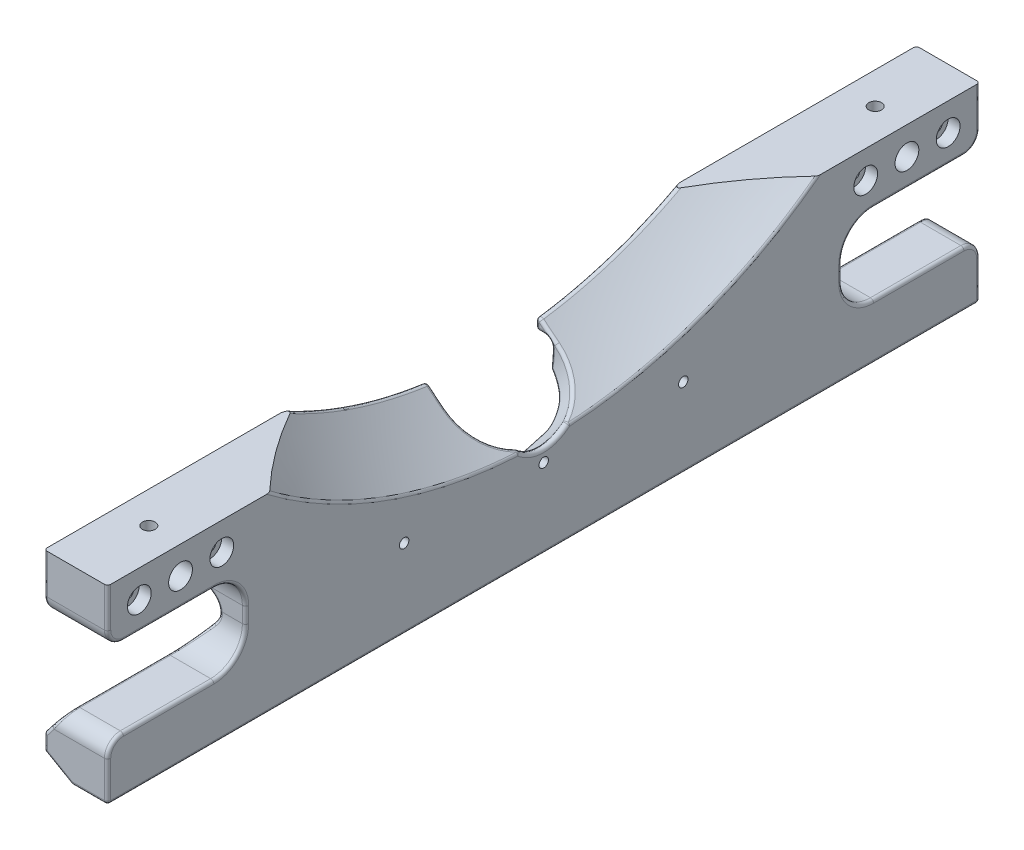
SolidWorks part; units mm, degrees
ref_plane "Front Plane" through (0, 0, 0) normal (0, 0, 1) x (1, 0, 0)
ref_plane "Top Plane" through (0, 0, 0) normal (0, 1, 0) x (1, 0, 0)
ref_plane "Right Plane" through (0, 0, 0) normal (1, 0, 0) x (0, 0, -1)
sketch "Sketch1" plane through (0, 0, 0) normal (0, 0, 1) x (1, 0, 0)
  line L0 (-140.462, -215.9) -> (-124.6241, -225.044)
  line L1 (-140.462, -146.05) -> (-115.062, -146.05)
  line L2 (-140.462, -146.05) -> (-140.462, -215.9)
  line L4 (-115.062, -146.05) -> (-115.062, -225.044)
  line L5 (-124.6241, -225.044) -> (-115.062, -225.044)
  dimension "D1" = 115.062
  dimension "D2" = 25.4
  dimension "D3" = 146.05
  dimension "D4" = 69.85
  dimension "D5" = 60
  dimension "D6" = 78.994
extrude "Boss-Extrude1" add sketch "Sketch1" along normal mid plane 349.25
sketch "Sketch11" plane through (-140.462, 0, 0) normal (-1, 0, 0) x (0, 0, 1)
  line L0 (0, 0) -> (0, -265.0834) construction
  line L1 (-174.625, -146.05) -> (-22.225, -146.05)
  line L2 (-174.625, -146.05) -> (-174.625, -168.275)
  line L3 (-174.625, -168.275) -> (-22.225, -168.275)
  line L4 (-22.225, -146.05) -> (-22.225, -168.275)
  line L5 (22.225, -146.05) -> (22.225, -168.275)
  line L6 (174.625, -168.275) -> (22.225, -168.275)
  line L7 (174.625, -146.05) -> (174.625, -168.275)
  line L8 (174.625, -146.05) -> (22.225, -146.05)
  dimension "D1" = 152.4
extrude "Boss-Extrude2" [suppressed] add sketch "Sketch11" along normal blind 38.1
sketch "Sketch2" plane through (0, 0, 0) normal (0, 0, 1) x (1, 0, 0)
  line L0 (0, 0) -> (0, -257.1396) construction
  line L1 (-199.2378, -83.1693) -> (-29.8683, -83.1693)
  line L2 (-29.8683, -83.1693) -> (-29.8683, -213.824)
  arc A0 (-199.2378, -83.1693) -> (-29.8683, -213.824) centre (0, 0) ccw
  dimension "D1" = 215.9
revolve "Cut-Revolve1" cut sketch "Sketch2" angle 360 about L0
sketch "Sketch4" plane through (-140.462, 0, 0) normal (-1, 0, 0) x (0, 0, 1)
  line L0 (174.625, -146.05) -> (174.625, -215.9) construction
  line L1 (174.625, -168.275) -> (132.08, -168.275)
  line L2 (174.625, -168.275) -> (174.625, -200.025)
  line L3 (174.625, -200.025) -> (132.08, -200.025)
  line L4 (119.38, -180.975) -> (119.38, -187.325)
  line L6 (0, 0) -> (0, -251.7179) construction
  line L7 (-119.38, -180.975) -> (-119.38, -187.325)
  line L8 (-174.625, -200.025) -> (-132.08, -200.025)
  line L9 (-174.625, -168.275) -> (-174.625, -200.025)
  line L10 (-174.625, -168.275) -> (-132.08, -168.275)
  line L11 (174.625, -146.05) -> (74.516, -146.05) construction
  arc A0 (132.08, -168.275) -> (119.38, -180.975) centre (132.08, -180.975) ccw
  arc A1 (132.08, -200.025) -> (119.38, -187.325) centre (132.08, -187.325) cw
  arc A2 (-119.38, -187.325) -> (-132.08, -200.025) centre (-132.08, -187.325) cw
  arc A3 (-119.38, -180.975) -> (-132.08, -168.275) centre (-132.08, -180.975) ccw
  point P17 (119.38, -168.275)
  point P20 (119.38, -200.025)
  point P23 (-119.38, -200.025)
  point P26 (-119.38, -168.275)
  dimension "D3" = 12.7
  dimension "D1" = 53.975
  dimension "D2" = 31.75
  dimension "D4" = 119.38
  dimension "D5" = 22.225
extrude "Cut-Extrude1" cut sketch "Sketch4" against normal through all
hole_wizard "#10-24 Tapped Hole1" positions "Sketch7" profile "Sketch6" tap size "#10-24" standard "ANSI Inch"
sketch "Sketch7" plane through (0, -146.05, 0) normal (0, 1, 0) x (1, 0, 0)
  point P10 (-165.862, 88.265)
  point P16 (-165.862, -88.265)
sketch "Sketch6" plane through (-165.862, -146.05, -88.265) normal (1, 0, 0) x (0, 0, 1)
  line L0 (0, 0) -> (0, 78.994)
  line L1 (0, 78.994) -> (1.8986, 78.994)
  line L2 (1.8986, 78.994) -> (1.8986, 0)
  line L5 (1.8986, 0) -> (0, 0)
  line L11 (0, -6.35) -> (0, 107.95) construction
  dimension "Thru Tap Drill Dia." = 3.7973
  dimension "Thru Tap Drill Depth" = 78.994
hole_wizard "#10 Clearance Hole1" positions "Sketch19" profile "Sketch18" hole size "#10" standard "ANSI Inch"
sketch "Sketch19" plane through (0, -168.275, 0) normal (0, -1, 0) x (-1, 0, 0)
  point P0 (165.862, -145.415)
  point P3 (127.762, -145.415)
  point P6 (165.862, 145.415)
  point P9 (127.762, 145.415)
sketch "Sketch18" plane through (-165.862, -168.275, 145.415) normal (1, 0, 0) x (0, 0, -1)
  line L0 (0, 0) -> (0, 22.225)
  line L1 (0, 22.225) -> (2.5527, 22.225)
  line L2 (2.5527, 22.225) -> (2.5527, 0)
  line L5 (2.5527, 0) -> (0, 0)
  line L11 (0, -6.35) -> (0, 107.95) construction
  dimension "Thru Hole Dia." = 5.1054
  dimension "Thru Hole Depth" = 22.225
fillet "Fillet3" [suppressed] radius 12.7
sketch "Sketch16" [suppressed] plane through (0, 0, -22.225) normal (0, 0, 1) x (1, 0, 0)
  line L0 (-178.562, -146.05) -> (-157.4429, -146.05) construction
  line L3 (-140.462, -168.275) -> (-140.462, -162.4478) construction
  line L4 (-178.562, -146.05) -> (-157.4429, -146.05)
  line L5 (-178.562, -146.05) -> (-178.562, -168.275)
  line L6 (-178.562, -168.275) -> (-140.462, -168.275)
  line L7 (-140.462, -168.275) -> (-140.462, -162.4478)
  arc A1 (-157.4429, -146.05) -> (-140.462, -162.4478) centre (0, 0) ccw construction
  arc A3 (-157.4429, -146.05) -> (-140.462, -162.4478) centre (0, 0) ccw
extrude "Boss-Extrude4" [suppressed] add sketch "Sketch16" along normal up to surface (44.45 mm away)
fillet "Fillet4" [suppressed] radius 6.35
hole_wizard "#10-24 Tapped Hole3" positions "Sketch13" profile "Sketch12" tap size "#10-24" standard "ANSI Inch"
sketch "Sketch13" plane through (-140.462, 0, 0) normal (-1, 0, 0) x (0, 0, 1)
  line L0 (-55.88, -190.5) -> (116.4714, -190.5) construction
  line L5 (-109.7403, -146.05) -> (-174.625, -146.05) construction
  point P0 (-55.88, -190.5)
  point P2 (0, -190.5)
  point P4 (55.88, -190.5)
  dimension "D1" = 55.88
  dimension "D2" = 55.88
  dimension "D3" = 44.45
sketch "Sketch12" plane through (-140.462, -190.5, -55.88) normal (0, 1, 0) x (0, 0, 1)
  line L0 (0, 0) -> (0, 25.4)
  line L1 (0, 25.4) -> (1.8986, 25.4)
  line L2 (1.8986, 25.4) -> (1.8986, 0)
  line L5 (1.8986, 0) -> (0, 0)
  line L11 (0, -6.35) -> (0, 107.95) construction
  dimension "Thru Tap Drill Dia." = 3.7973
  dimension "Thru Tap Drill Depth" = 25.4
sketch "Sketch17" plane through (0, 0, 0) normal (1, 0, 0) x (0, 0, -1)
  line L0 (-172.6511, -129.6318) -> (172.6511, -129.6318)
  line L1 (-201.1468, 0) -> (223.5225, 0) construction
  arc A0 (172.6511, -129.6318) -> (-172.6511, -129.6318) centre (0, 0) cw
  dimension "D1" = 215.9
revolve "Cut-Revolve4" [suppressed] cut sketch "Sketch17" angle 360 about L1
fillet "Fillet5" [suppressed] radius 12.7
fillet "Fillet6" [suppressed] radius 6.35
fillet "Fillet7" radius 6.35 4 edges at (-127.762, -200.025, -174.625) (-127.762, -168.275, -174.625) (-127.762, -200.025, 174.625) (-127.762, -168.275, 174.625)
sketch "Sketch20" plane through (0, 0, -174.625) normal (0, 0, -1) x (-1, 0, 0)
  line L0 (115.062, -146.05) -> (140.462, -146.05) construction
  line L1 (112.8411, -229.5307) -> (140.256, -229.5307)
  line L2 (112.8411, -229.5307) -> (112.8411, -222.25)
  line L3 (112.8411, -222.25) -> (140.256, -222.25)
  line L4 (140.256, -229.5307) -> (140.256, -222.25)
  dimension "D1" = 76.2
extrude "Cut-Extrude2" cut sketch "Sketch20" against normal through all
hole_wizard "3/8 (0.375) Diameter Hole1" positions "Sketch22" profile "Sketch21" hole size "3/8" standard "ANSI Inch"
sketch "Sketch22" plane through (-140.462, 0, 0) normal (-1, 0, 0) x (0, 0, 1)
  line L0 (-145.415, -175.1062) -> (-145.415, -134.7462) construction
  line L1 (-147.9677, -146.05) -> (-147.9677, -168.275) construction
  line L2 (-142.8623, -168.275) -> (-142.8623, -146.05) construction
  line L5 (-163.2553, -157.1625) -> (-130.2244, -157.1625) construction
  line L6 (-74.516, -146.05) -> (-174.625, -146.05) construction
  line L7 (-132.08, -168.275) -> (-168.275, -168.275) construction
  line L8 (145.415, -139.1729) -> (145.415, -177.9676) construction
  line L10 (142.8623, -146.05) -> (142.8623, -168.275) construction
  line L11 (147.9677, -168.275) -> (147.9677, -146.05) construction
  line L12 (136.7332, -157.1625) -> (151.9983, -157.1625) construction
  line L14 (174.625, -146.05) -> (74.516, -146.05) construction
  line L15 (168.275, -168.275) -> (132.08, -168.275) construction
  point P0 (-145.415, -157.1625)
  point P2 (145.415, -157.1625)
sketch "Sketch21" plane through (-140.462, -157.1625, -145.415) normal (0, 1, 0) x (0, 0, 1)
  line L0 (0, 0) -> (0, 25.4)
  line L1 (0, 25.4) -> (4.7625, 25.4)
  line L2 (4.7625, 25.4) -> (4.7625, 0)
  line L5 (4.7625, 0) -> (0, 0)
  line L11 (0, -6.35) -> (0, 107.95) construction
  dimension "Thru Hole Dia." = 9.525
  dimension "Thru Hole Depth" = 25.4
hole_wizard "CBORE for #10 Socket Head Cap Screw1" positions "Sketch24" profile "Sketch23" counterbore size "#10" standard "ANSI Inch"
sketch "Sketch24" plane through (-115.062, -3.5007, 17.4995) normal (-1, 0, 0) x (0, 0, 1)
  line L0 (-191.3128, -153.6618) -> (-76.1566, -153.6618) construction
  line L1 (-92.0155, -142.5493) -> (-192.1245, -142.5493) construction
  line L2 (-149.5795, -164.7743) -> (-185.7745, -164.7743) construction
  line L3 (-192.1245, -142.5493) -> (-192.1245, -158.4243) construction
  point P8 (-179.4245, -153.6618)
  point P10 (-146.4045, -153.6618)
  dimension "D1" = 12.7
  dimension "D2" = 33.02
sketch "Sketch23" plane through (-115.062, -157.1625, -161.925) normal (0, 1, 0) x (0, 0, -1)
  line L0 (0, 0) -> (0, 25.4)
  line L1 (0, 25.4) -> (2.5527, 25.4)
  line L3 (2.5527, 25.4) -> (2.5527, 4.826)
  line L4 (2.5527, 4.826) -> (4.7625, 4.826)
  line L5 (4.7625, 4.826) -> (4.7625, 0)
  line L7 (4.7625, 0) -> (0, 0)
  line L11 (0, -6.35) -> (0, 107.95) construction
  dimension "Thru Hole Dia." = 5.1054
  dimension "Thru Hole Depth" = 25.4
  dimension "C'Bore Dia." = 9.525
  dimension "C'Bore Depth" = 4.826
mirror "Mirror1" about plane through (0, 0, 0) normal (0, 0, 1) of "CBORE for #10 Socket Head Cap Screw1"
ref_plane "Plane1" through (-114.4688, -146.5134, 0) normal (0.6157, 0.788, 0) x (0, 0, -1)
sketch "Sketch27" plane through (-114.4688, -146.5134, 0) normal (0.6157, 0.788, 0) x (0, 0, -1)
  line L2 (-22.225, 0) -> (-22.225, 38.1)
  line L3 (-22.225, 38.1) -> (22.225, 38.1)
  line L4 (22.225, 0) -> (22.225, 38.1)
  arc A0 (-22.225, 0) -> (22.225, 0) centre (0, 0) ccw
  dimension "D1" = 44.45
  dimension "D2" = 38.1
extrude "Cut-Extrude4" cut sketch "Sketch27" against normal through all
sketch "Sketch28" plane through (-140.462, 0, 0) normal (-1, 0, 0) x (0, 0, 1)
  line L0 (168.275, -168.275) -> (132.08, -168.275) construction
  line L1 (-124.0137, -168.275) -> (122.2507, -168.275)
  line L2 (-124.0137, -168.275) -> (-124.0137, -200.025)
  line L3 (-124.0137, -200.025) -> (122.2507, -200.025)
  line L4 (122.2507, -168.275) -> (122.2507, -200.025)
  line L5 (132.08, -200.025) -> (168.275, -200.025) construction
extrude "Cut-Extrude5" cut sketch "Sketch28" against normal blind 6.35
fillet "Fillet8" radius 3.175 4 edges at (-134.112, -168.275, 72.2378) (-134.112, -200.025, -68.8787) (-134.112, -168.275, -73.1193) (-134.112, -200.025, 67.9972)
fillet "Fillet9" radius 1.27 58 edges at (-135.0419, -169.2049, 22.225) (-134.112, -171.5528, 22.225) (-135.0444, -199.0975, -15.2577) (-135.0419, -169.2049, -22.225) (-134.112, -171.5528, -22.225) (-121.1512, -177.8718, -17.2285) (-136.3807, -165.889, 22.225) (-134.112, -185.2546, 20.5877) (-140.462, -215.8825, 0) (-134.112, -185.2546, -20.5877) (-136.3807, -165.889, -22.225) (-115.062, -214.3125, -174.625) (-115.062, -201.8849, -172.7651) (-115.062, -153.9875, -174.625) (-115.062, -166.4151, -172.7651) (-115.062, -168.275, -150.1775) (-115.062, -171.9947, -123.0997) (-115.062, -184.15, -119.38) (-115.062, -196.3053, -123.0997) (-115.062, -153.9875, 174.625) (-115.062, -166.4151, 172.7651) (-115.062, -168.275, 150.1775) (-115.062, -171.9947, 123.0997) (-115.062, -184.15, 119.38) (-115.062, -196.3053, 123.0997) (-115.062, -214.3125, 174.625) (-115.062, -201.8849, 172.7651) (-140.462, -153.9875, -174.625) (-140.462, -166.4151, -172.7651) (-140.462, -153.9875, 174.625) (-140.462, -166.4151, 172.7651) (-140.462, -211.1375, 174.625) (-140.462, -201.8849, 172.7651) (-140.462, -211.1375, -174.625) (-140.462, -201.8849, -172.7651) (-115.062, -200.025, -150.1775) (-115.062, -200.025, 150.1775) (-140.462, -168.275, -150.1775) (-140.462, -168.275, 150.1775) (-140.462, -200.025, 150.1775) (-140.462, -200.025, -150.1775) (-134.112, -175.7497, -120.5047) (-134.112, -192.5503, -120.5047) (-134.112, -191.5945, 120.1192) (-134.112, -176.7055, 120.1192) (-134.112, -184.15, -119.38) (-134.112, -184.15, 119.38) (-140.462, -169.0195, -127.7957) (-140.462, -169.4984, 126.6414) (-140.462, -198.8016, 126.6414) (-140.462, -199.2805, -127.7957) (-138.8745, -168.275, 22.225) (-138.8297, -200.025, 17.4623) (-134.8919, -198.9342, 15.2369) (-138.8297, -200.025, -17.4623) (-138.8745, -168.275, -22.225)
sketch "Sketch29" plane through (0, 0, -174.625) normal (0, 0, -1) x (-1, 0, 0)
  line L2 (124.582, -189.1656) -> (137.5109, -205.7138)
  line L3 (126.9277, -192.1679) -> (142.7541, -212.4248)
  line L4 (149.8421, -166.2069) -> (142.7541, -212.4248)
  line L5 (149.8421, -166.2069) -> (125.0198, -185.6002)
  line L6 (149.8421, -166.2069) -> (128.0221, -183.2546)
  arc A0 (126.9277, -192.1679) -> (128.0221, -183.2546) centre (131.9315, -188.2584) cw
  dimension "D3" = 6.35
  dimension "D1" = 2.54
  dimension "D2" = 2.54
extrude "Cut-Extrude6" cut sketch "Sketch29" against normal through all and the other way through all
fillet "Fillet10" radius 1.27 59 edges at (-122.8977, -222.25, 174.625) (-115.434, -222.25, 174.253) (-122.8977, -222.25, -174.625) (-115.434, -222.25, -174.253) (-134.3277, -219.4416, 174.625) (-140.09, -216.1148, 174.253) (-140.462, -215.9, 88.4153) (-140.4102, -215.9299, 0.9355) (-134.3277, -219.4416, -174.625) (-140.09, -216.1148, -174.253) (-115.062, -171.8555, 61.9614) (-115.062, -171.8555, -61.9614) (-140.462, -165.48, 22.225) (-140.462, -162.6362, 22.7118) (-140.462, -165.48, -22.225) (-140.462, -162.7971, -22.5774) (-129.4809, -182.1148, 119.38) (-126.4449, -185.0617, 119.38) (-125.6657, -189.2891, 119.5328) (-131.3901, -197.8795, 125.0165) (-133.0663, -200.025, 150.1775) (-134.5194, -201.8849, 172.7651) (-138.6097, -207.1203, 174.625) (-140.09, -209.0149, 174.253) (-140.462, -209.491, 93.3835) (-140.2933, -209.2751, 12.7565) (-140.3729, -209.377, -12.8871) (-133.4716, -200.5438, -12.6264) (-133.4716, -200.5438, 12.6264) (-125.621, -187.5519, -14.9141) (-125.7314, -189.6301, 13.4802) (-130.469, -181.3429, 20.3935) (-133.9046, -178.6586, 22.1839) (-133.8854, -178.6736, -22.1529) (-130.469, -181.3429, -20.3935) (-140.462, -209.491, -93.3835) (-140.09, -209.0149, -174.253) (-138.6097, -207.1203, -174.625) (-134.5194, -201.8849, -172.7651) (-133.0663, -200.025, -150.1775) (-131.3901, -197.8795, -125.0165) (-125.9369, -190.3529, -119.7462) (-126.4449, -185.0617, -119.38) (-129.4809, -182.1148, -119.38) (-115.062, -222.25, 0) (-129.4635, -222.25, 0) (-140.462, -215.9, -88.4153) (-140.462, -156.277, 49.6058) (-140.462, -156.277, -49.6058) (-134.112, -178.4966, 70.6205) (-134.112, -178.4966, -70.6205) (-133.7037, -178.8156, 119.223) (-131.8925, -180.2306, 119.4018) (-131.8925, -180.2306, -119.4018) (-133.8737, -178.6828, -119.0507) (-140.462, -168.275, 72.8728) (-140.462, -167.903, 22.597) (-140.462, -168.275, -73.7543) (-140.462, -167.903, -22.597)
